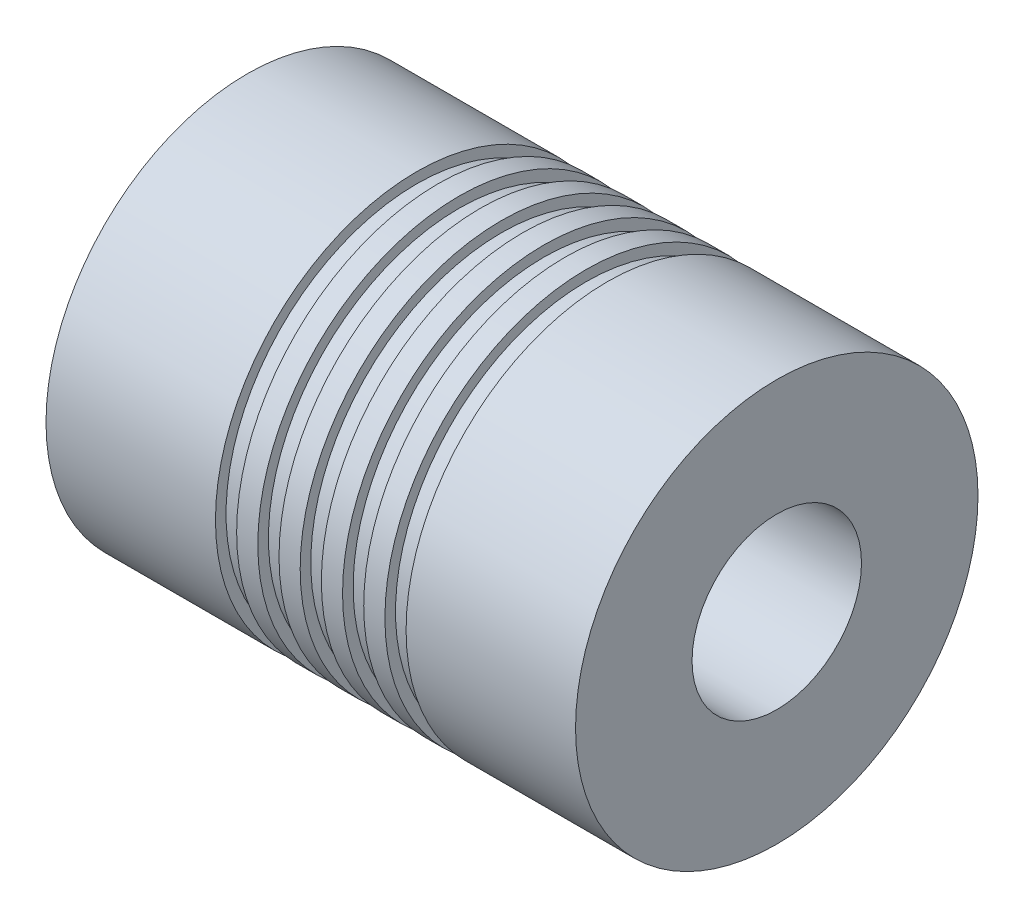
SolidWorks part; units mm, degrees
ref_plane "Ebene vorne" through (0, 0, 0) normal (0, 0, 1) x (1, 0, 0)
ref_plane "Ebene oben" through (0, 0, 0) normal (0, 1, 0) x (1, 0, 0)
ref_plane "Ebene rechts" through (0, 0, 0) normal (1, 0, 0) x (0, 0, -1)
sketch "Skizze1" plane through (0, 0, 0) normal (0, 0, 1) x (1, 0, 0)
  line L0 (-12.5, 0) -> (12.5, 0) construction
  line L1 (-12.5, 2.5) -> (-12.5, 9.5)
  line L2 (-12.5, 9.5) -> (-4.5, 9.5)
  line L3 (12.5, 9.5) -> (12.5, 4)
  line L4 (12.5, 4) -> (0, 4)
  line L5 (0, 4) -> (0, 2.5)
  line L6 (0, 2.5) -> (-12.5, 2.5)
  line L7 (-4.5, 9.5) -> (-4.5, 9)
  line L8 (-4.5, 9) -> (-3.5, 9)
  line L9 (-3.5, 9) -> (-3.5, 9.5)
  line L11 (-2.5, 9.5) -> (-2.5, 9)
  line L12 (-2.5, 9) -> (-1.5, 9)
  line L13 (-1.5, 9) -> (-1.5, 9.5)
  line L15 (-0.5, 9.5) -> (-0.5, 9)
  line L16 (-0.5, 9) -> (0.5, 9)
  line L17 (0.5, 9) -> (0.5, 9.5)
  line L19 (1.5, 9.5) -> (1.5, 9)
  line L20 (1.5, 9) -> (2.5, 9)
  line L21 (2.5, 9) -> (2.5, 9.5)
  line L23 (3.5, 9.5) -> (3.5, 9)
  line L24 (3.5, 9) -> (4.5, 9)
  line L25 (4.5, 9) -> (4.5, 9.5)
  line L26 (0, 9) -> (0, 4) construction
  line L27 (4.5, 9.5) -> (12.5, 9.5)
  line L28 (2.5, 9.5) -> (3.5, 9.5)
  line L29 (0.5, 9.5) -> (1.5, 9.5)
  line L30 (-1.5, 9.5) -> (-0.5, 9.5)
  line L31 (-3.5, 9.5) -> (-2.5, 9.5)
  point P2 (0, 0)
  dimension "D1" = 25
  dimension "D2" = 5
  dimension "D3" = 8
  dimension "D4" = 19
  dimension "D5" = 1
  dimension "D6" = 1
  dimension "D7" = 1
  dimension "D8" = 1
  dimension "D9" = 1
  dimension "D10" = 0.5
revolve "Rotation1" add sketch "Skizze1" angle 360 about L0
